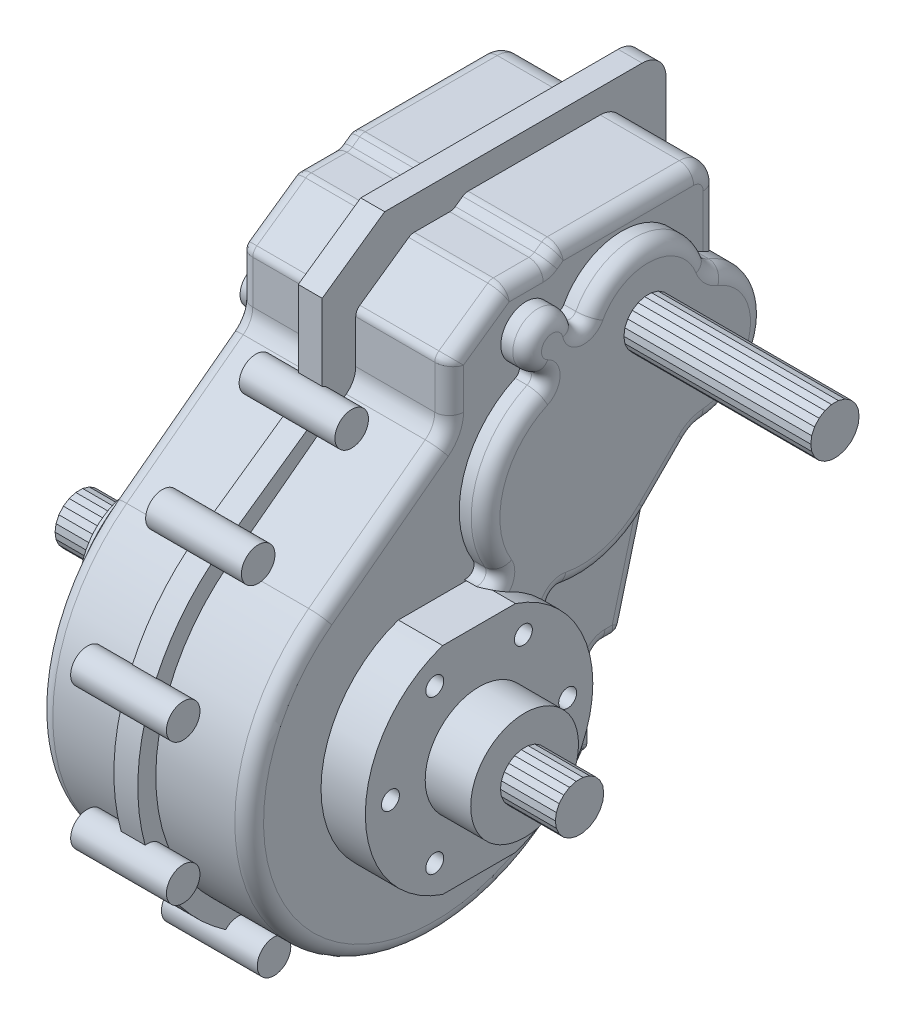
SolidWorks part; units mm, degrees
ref_plane "Front Plane" through (0, 0, 0) normal (0, 0, 1) x (1, 0, 0)
ref_plane "Top Plane" through (0, 0, 0) normal (0, 1, 0) x (1, 0, 0)
ref_plane "Right Plane" through (0, 0, 0) normal (1, 0, 0) x (0, 0, -1)
sketch "Sketch1" plane through (0, 0, 0) normal (1, 0, 0) x (0, 0, -1)
  line L0 (0, 0) -> (99.1616, 141.605) construction
  line L1 (-107.95, 0) -> (107.95, 0) construction
  line L2 (0, 198.755) -> (0, -198.755) construction
  line L3 (3.9933, 137.5321) -> (501.9326, 137.5321) construction
  line L4 (-61.9176, 88.4275) -> (-10.16, 124.6685)
  line L5 (-10.16, 124.6685) -> (-10.16, 175.563)
  line L6 (-10.16, 175.563) -> (22.9616, 198.755)
  line L7 (22.9616, 198.755) -> (159.4866, 198.755)
  line L8 (172.1866, 186.055) -> (172.1866, 149.0291)
  line L9 (169.3968, 142.2939) -> (168.019, 140.9161)
  line L10 (104.3531, -27.6339) -> (129.1752, 66.101)
  circle A0 centre (0, 0) radius 107.95 construction
  circle A1 centre (99.1616, 141.605) radius 33.9725 construction
  circle A2 centre (46.99, 0) radius 4.7625 construction
  circle A3 centre (0, 0) radius 46.99 construction
  circle A4 centre (0, 0) radius 46.99 construction
  circle A5 centre (23.495, -40.6945) radius 4.7625 construction
  circle A6 centre (0, 0) radius 46.99
  circle A7 centre (-23.495, -40.6945) radius 4.7625 construction
  circle A8 centre (0, 0) radius 46.99
  circle A9 centre (-46.99, 0) radius 4.7625 construction
  circle A10 centre (0, 0) radius 46.99
  circle A11 centre (-23.495, 40.6945) radius 4.7625 construction
  circle A12 centre (0, 0) radius 46.99
  circle A13 centre (23.495, 40.6945) radius 4.7625 construction
  circle A14 centre (63.7424, 91.0256) radius 50.8 construction
  circle A15 centre (126.1618, 114.6048) radius 42.8625 construction
  arc A16 (159.4866, 198.755) -> (172.1866, 186.055) centre (159.4866, 186.055) cw
  arc A17 (165.9192, 130.6216) -> (136.1608, 72.9249) centre (126.1618, 114.6048) cw
  arc A18 (-61.9176, 88.4275) -> (104.3531, -27.6339) centre (0, 0) ccw
  arc A19 (172.1866, 149.0291) -> (169.3968, 142.2939) centre (162.6616, 149.0291) cw
  arc A20 (168.019, 140.9161) -> (165.9192, 130.6216) centre (174.7542, 134.1809) ccw
  arc A21 (136.1608, 72.9249) -> (129.1752, 66.101) centre (138.3828, 63.6627) ccw
  point P7 (0, 0)
  point P10 (0, 0)
  point P33 (0, 0)
  point P44 (172.1866, 198.755)
  point P45 (168.7079, 141.605)
  point P54 (163.2294, 136.1265)
  point P57 (130.7338, 71.9868)
  dimension "D3" = 215.9
  dimension "D4" = 67.945
  dimension "D6" = 9.525
  dimension "D9" = 101.6
  dimension "D12" = 85.725
  dimension "D16" = 12.7
  dimension "D21" = 9.525
  dimension "D1" = 141.605
  dimension "D2" = 99.1616
  dimension "D5" = 46.99
  dimension "D8" = 111.125
  dimension "D10" = 27.0002
  dimension "D11" = 27.0002
  dimension "D13" = 57.15
  dimension "D14" = 76.2
  dimension "D15" = 149.225
  dimension "D17" = 135
  dimension "D18" = 10.16
  dimension "D19" = 145
  dimension "D20" = 4.572
  dimension "D7" = 6
extrude "Boss-Extrude1" add sketch "Sketch1" along normal mid plane 12.7 contours A21 A17 A20 L9 A19 L8 A16 L7 L6 L5 L4 A18 L10 A6 | A6
sketch "Sketch3" plane through (0, 0, 0) normal (1, 0, 0) x (0, 0, -1)
  line L0 (-59.2336, 78.6057) -> (2.5631, 125.1728)
  line L1 (7.62, 135.3155) -> (7.62, 158.2365)
  line L2 (9.7862, 162.3978) -> (35.7307, 180.5643)
  line L3 (38.6445, 181.483) -> (57.5024, 181.483)
  line L4 (60.4162, 182.4017) -> (64.3215, 185.1363)
  line L5 (67.2353, 186.055) -> (137.2616, 186.055)
  line L6 (149.9616, 173.355) -> (149.9616, 142.288)
  line L7 (-10.16, 175.563) -> (22.9616, 198.755) construction
  line L8 (-107.95, 0) -> (107.95, 0) construction
  line L9 (0, 198.755) -> (0, -198.755) construction
  line L10 (172.1866, 186.055) -> (172.1866, 149.0291) construction
  line L11 (22.9616, 198.755) -> (159.4866, 198.755) construction
  line L12 (121.223, 70.7996) -> (100.953, -5.7454)
  line L13 (104.3531, -27.6339) -> (129.1752, 66.101) construction
  line L14 (96.0423, -9.525) -> (90.17, -9.525)
  line L15 (85.09, -14.605) -> (85.09, -53.213)
  line L16 (82.55, -55.753) -> (81.1116, -55.753)
  arc A0 (-59.2336, 78.6057) -> (81.1116, -55.753) centre (0, 0) ccw
  arc A1 (151.3743, 138.7726) -> (131.543, 80.0969) centre (126.1618, 114.6048) cw
  arc A2 (64.3215, 185.1363) -> (67.2353, 186.055) centre (67.2353, 180.975) cw
  arc A3 (57.5024, 181.483) -> (60.4162, 182.4017) centre (57.5024, 186.563) ccw
  arc A4 (35.7307, 180.5643) -> (38.6445, 181.483) centre (38.6445, 176.403) cw
  arc A5 (7.62, 158.2365) -> (9.7862, 162.3978) centre (12.7, 158.2365) cw
  arc A6 (149.9616, 142.288) -> (151.3743, 138.7726) centre (155.0416, 142.288) ccw
  arc A7 (90.17, -9.525) -> (85.09, -14.605) centre (90.17, -14.605) ccw
  arc A8 (100.953, -5.7454) -> (96.0423, -9.525) centre (96.0423, -4.445) cw
  arc A9 (85.09, -53.213) -> (82.55, -55.753) centre (82.55, -53.213) cw
  arc A10 (2.5631, 125.1728) -> (7.62, 135.3155) centre (-5.08, 135.3155) ccw
  arc A11 (137.2616, 186.055) -> (149.9616, 173.355) centre (137.2616, 173.355) cw
  arc A12 (131.543, 80.0969) -> (121.223, 70.7996) centre (133.4998, 67.5485) ccw
  point P32 (65.6336, 186.055)
  dimension "D1" = 98.425
  dimension "D9" = 34.925
  dimension "D14" = 5.08
  dimension "D15" = 2.54
  dimension "D16" = 12.7
  dimension "D2" = 37
  dimension "D3" = 7.62
  dimension "D4" = 22.225
  dimension "D5" = 22.225
  dimension "D6" = 12.7
  dimension "D7" = 4.572
  dimension "D8" = 33.528
  dimension "D10" = 8.89
  dimension "D11" = 85.09
  dimension "D12" = 9.525
  dimension "D13" = 46.228
extrude "Boss-Extrude2" add sketch "Sketch3" along normal mid plane 111.76
sketch "Sketch4" plane through (0, 0, 0) normal (1, 0, 0) x (0, 0, -1)
  circle A0 centre (0, 0) radius 28.575
  dimension "D1" = 57.15
extrude "Boss-Extrude3" add sketch "Sketch4" along normal mid plane 207.0608
sketch "Sketch5" plane through (0, 0, 0) normal (1, 0, 0) x (0, 0, -1)
  line L0 (-1.826, 12.7) -> (-5.33, 11.6711)
  line L1 (12.8306, 0) -> (12.3109, 3.6148)
  line L2 (12.3109, 3.6148) -> (10.7938, 6.9367)
  line L3 (10.7938, 6.9367) -> (8.4023, 9.6967)
  line L4 (8.4023, 9.6967) -> (5.33, 11.6711)
  line L5 (5.33, 11.6711) -> (1.826, 12.7)
  line L6 (1.826, 12.7) -> (-1.826, 12.7)
  line L7 (-5.33, 11.6711) -> (-8.4023, 9.6967)
  line L8 (-8.4023, 9.6967) -> (-10.7938, 6.9367)
  line L9 (-10.7938, 6.9367) -> (-12.3109, 3.6148)
  line L10 (-12.3109, 3.6148) -> (-12.8306, 0)
  line L11 (-12.8306, 0) -> (-12.3109, -3.6148)
  line L12 (-12.3109, -3.6148) -> (-10.7938, -6.9367)
  line L13 (-10.7938, -6.9367) -> (-8.4023, -9.6967)
  line L14 (-8.4023, -9.6967) -> (-5.33, -11.6711)
  line L15 (-5.33, -11.6711) -> (-1.826, -12.7)
  line L16 (-1.826, -12.7) -> (1.826, -12.7)
  line L17 (1.826, -12.7) -> (5.33, -11.6711)
  line L18 (5.33, -11.6711) -> (8.4023, -9.6967)
  line L19 (8.4023, -9.6967) -> (10.7938, -6.9367)
  line L20 (10.7938, -6.9367) -> (12.3109, -3.6148)
  line L21 (12.3109, -3.6148) -> (12.8306, 0)
  line L22 (-107.95, 0) -> (107.95, 0) construction
  circle A0 centre (0, 0) radius 12.7 construction
  dimension "D1" = 25.4
extrude "Boss-Extrude4" add sketch "Sketch5" along normal mid plane 265.3284
sketch "Sketch6" plane through (0, 0, 0) normal (1, 0, 0) x (0, 0, -1)
  line L0 (19.3128, 57.15) -> (-19.3128, 57.15)
  line L1 (-19.3128, -57.15) -> (19.3128, -57.15)
  arc A0 (19.3128, 57.15) -> (19.3128, -57.15) centre (0, 0) cw
  arc A1 (-19.3128, 57.15) -> (-19.3128, -57.15) centre (0, 0) ccw
  circle A2 centre (46.99, 0) radius 4.7625
  circle A3 centre (23.495, 40.6945) radius 4.7625
  circle A4 centre (-23.495, 40.6945) radius 4.7625
  circle A5 centre (-46.99, 0) radius 4.7625
  circle A6 centre (-23.495, -40.6945) radius 4.7625
  circle A7 centre (23.495, -40.6945) radius 4.7625
  dimension "D1" = 60.325
  dimension "D3" = 9.525
  dimension "D2" = 114.3
extrude "Boss-Extrude5" add sketch "Sketch6" along normal mid plane 158.75
sketch "Sketch7" plane through (0, 0, 0) normal (1, 0, 0) x (0, 0, -1)
  line L0 (20.2141, 64.8355) -> (15.6157, 58.2688) construction
  line L1 (54.0152, 41.1656) -> (49.4168, 34.599) construction
  line L2 (15.6157, 58.2688) -> (49.4168, 34.599) construction
  line L3 (0, 0) -> (15.6157, 58.2688) construction
  line L4 (0, 0) -> (49.4168, 34.599) construction
  line L5 (0, 0) -> (99.1616, 141.605) construction
  line L6 (99.662, 55.1031) -> (120.6472, 76.0867)
  arc A0 (42.6378, 137.2342) -> (20.2141, 64.8355) centre (63.7424, 91.0256) ccw
  circle A1 centre (63.7424, 91.0256) radius 50.8 construction
  arc A2 (54.0152, 41.1656) -> (99.662, 55.1031) centre (63.7424, 91.0256) ccw
  arc A3 (15.6157, 58.2688) -> (49.4168, 34.599) centre (0, 0) cw
  arc A4 (19.3128, -57.15) -> (19.3128, 57.15) centre (0, 0) ccw construction
  arc A5 (20.2141, 64.8355) -> (15.6157, 58.2688) centre (16.4556, 62.5741) cw
  arc A6 (54.0152, 41.1656) -> (49.4168, 34.599) centre (53.1753, 36.8604) ccw
  arc A7 (128.703, 79.7724) -> (138.8862, 147.1293) centre (126.1618, 114.6048) ccw
  arc A8 (131.543, 80.0969) -> (151.3743, 138.7726) centre (126.1618, 114.6048) ccw construction
  arc A9 (131.6861, 154.3294) -> (68.432, 158.2016) centre (99.1616, 141.605) ccw
  arc A10 (42.6786, 144.1466) -> (61.3646, 159.1672) centre (48.3616, 156.21) cw
  arc A11 (42.6378, 137.2342) -> (42.6786, 144.1466) centre (41.0549, 140.6999) ccw
  arc A12 (61.3646, 159.1672) -> (68.432, 158.2016) centre (65.0797, 160.0122) ccw
  arc A13 (138.8862, 147.1293) -> (131.6861, 154.3294) centre (143.5132, 158.9564) cw
  arc A14 (128.703, 79.7724) -> (120.6472, 76.0867) centre (129.6271, 67.106) ccw
  point P10 (32.5162, 46.4339)
  dimension "D2" = 34.925
  dimension "D5" = 13.335
  dimension "D6" = 3.81
  dimension "D8" = 12.7
  dimension "D1" = 40
  dimension "D3" = 50.8
  dimension "D4" = 14.605
  dimension "D7" = 10
extrude "Boss-Extrude6" add sketch "Sketch7" along normal blind 69.85
sketch "Sketch8" plane through (0, 0, 0) normal (1, 0, 0) x (0, 0, -1)
  line L1 (111.9922, 141.605) -> (111.4725, 145.2198)
  line L2 (111.4725, 145.2198) -> (109.9554, 148.5417)
  line L3 (109.9554, 148.5417) -> (107.5639, 151.3017)
  line L4 (107.5639, 151.3017) -> (104.4916, 153.2761)
  line L5 (104.4916, 153.2761) -> (100.9876, 154.305)
  line L6 (100.9876, 154.305) -> (97.3356, 154.305)
  line L7 (97.3356, 154.305) -> (93.8316, 153.2761)
  line L8 (93.8316, 153.2761) -> (90.7593, 151.3017)
  line L9 (90.7593, 151.3017) -> (88.3678, 148.5417)
  line L10 (88.3678, 148.5417) -> (86.8507, 145.2198)
  line L11 (86.8507, 145.2198) -> (86.331, 141.605)
  line L12 (86.331, 141.605) -> (86.8507, 137.9902)
  line L13 (86.8507, 137.9902) -> (88.3678, 134.6683)
  line L14 (88.3678, 134.6683) -> (90.7593, 131.9083)
  line L15 (90.7593, 131.9083) -> (93.8316, 129.9339)
  line L16 (93.8316, 129.9339) -> (97.3356, 128.905)
  line L17 (97.3356, 128.905) -> (100.9876, 128.905)
  line L18 (100.9876, 128.905) -> (104.4916, 129.9339)
  line L19 (104.4916, 129.9339) -> (107.5639, 131.9083)
  line L20 (107.5639, 131.9083) -> (109.9554, 134.6683)
  line L21 (109.9554, 134.6683) -> (111.4725, 137.9902)
  line L22 (111.4725, 137.9902) -> (111.9922, 141.605)
  circle A0 centre (99.1616, 141.605) radius 12.7 construction
  dimension "D1" = 25.4
extrude "Boss-Extrude7" add sketch "Sketch8" along normal blind 168.9354
sketch "Sketch9" plane through (0, 0, 0) normal (1, 0, 0) x (0, 0, -1)
  circle A0 centre (63.7424, 91.0256) radius 9.525
  dimension "D1" = 19.05
extrude "Boss-Extrude8" add sketch "Sketch9" against normal blind 101.6
sketch "Sketch10" plane through (0, 0, 0) normal (1, 0, 0) x (0, 0, -1)
  line L3 (0, 0) -> (-23.495, -40.6945) construction
  line L4 (2.5631, 125.1728) -> (-59.2336, 78.6057) construction
  circle A0 centre (0, 0) radius 109.5375 construction
  circle A1 centre (-54.7688, -94.8623) radius 8.89
  circle A2 centre (-102.9316, -37.464) radius 8.89
  circle A3 centre (-102.9316, 37.464) radius 8.89
  circle A4 centre (-63.1693, 89.488) radius 8.89
  circle A5 centre (-13.5702, 126.8801) radius 8.89
  arc A6 (-5.3026, 130.148) -> (6.2857, 129.6488) centre (0.6028, 132.4822) ccw
  arc A7 (2.5631, 125.1728) -> (7.62, 135.3155) centre (-5.08, 135.3155) ccw construction
  circle A8 centre (83.9106, -70.4093) radius 8.89
  circle A9 centre (19.021, -107.8734) radius 8.89
  circle A10 centre (-54.7687, 94.8623) radius 8.89
  circle A11 centre (19.021, 107.8734) radius 8.89
  circle A12 centre (83.9106, 70.4093) radius 8.89
  circle A13 centre (109.5375, 0) radius 8.89
  arc A14 (-18.6626, 119.5932) -> (-18.4785, 109.3169) centre (-22.3001, 114.3882) cw
  arc A15 (-54.7636, 92.3823) -> (-44.938, 89.3782) centre (-48.7595, 94.4496) ccw
  arc A16 (-67.9773, 82.0104) -> (-67.0837, 72.0226) centre (-71.4117, 76.6693) cw
  arc A17 (-59.2336, 78.6057) -> (81.1116, -55.753) centre (0, 0) ccw construction
  arc A18 (-96.9783, 44.0663) -> (-87.1062, 45.8257) centre (-92.7259, 48.7822) ccw
  arc A20 (-59.2336, 78.6057) -> (81.1116, -55.753) centre (0, 0) ccw construction
  arc A21 (-102.6149, 28.5797) -> (-96.1834, 20.8862) centre (-102.3888, 22.2337) cw
  arc A22 (-102.6149, -28.5797) -> (-96.1834, -20.8862) centre (-102.3888, -22.2337) ccw
  arc A23 (-96.9783, -44.0663) -> (-87.1062, -45.8257) centre (-92.7259, -48.7822) cw
  arc A24 (-60.237, -87.8529) -> (-60.2554, -77.8253) centre (-64.1428, -82.8462) ccw
  arc A25 (-45.9644, -96.0932) -> (-37.271, -91.0953) centre (-39.6755, -96.9724) cw
  arc A26 (10.3266, -106.0188) -> (3.8668, -98.349) centre (4.1163, -104.6941) ccw
  arc A27 (26.5568, -103.157) -> (30.0037, -93.7404) centre (31.9394, -99.7881) cw
  arc A28 (66.1797, -72.8542) -> (76.0582, -74.5773) centre (70.4493, -77.5544) cw
  arc A29 (87.7418, -62.3873) -> (84.3461, -55.0091) centre (90.4784, -56.6572) cw
  arc A30 (82.55, -55.753) -> (85.09, -53.213) centre (82.55, -53.213) ccw construction
  point P25 (0, 0)
  dimension "D1" = 219.075
  dimension "D2" = 17.78
  dimension "D3" = 9
  dimension "D4" = 6.35
extrude "Boss-Extrude9" add sketch "Sketch10" along normal mid plane 50.8 contours A4 | A5 | A3 | A8 | A2 | A1 | A9
fillet "Fillet2" radius 7.62 59 edges at (-55.88, -55.753, -81.8308) (-55.88, -55.0091, -84.3461) (-55.88, -33.909, -85.09) (-55.88, -11.0129, -86.5779) (-55.88, -9.525, -93.1061) (-55.88, -8.4707, -99.1407) (-55.88, 32.5271, -111.088) (-55.88, 76.9841, -124.9993) (-55.88, 103.4222, -159.2481) (-55.88, 140.3937, -150.328) (-55.88, 157.8215, -149.9616) (-55.88, 182.3353, -146.2419) (-55.88, 186.055, -102.2485) (-55.88, 185.8199, -65.7077) (-55.88, 183.769, -62.3689) (-55.88, 181.7181, -59.03) (-55.88, 181.483, -48.0734) (-55.88, 181.2479, -37.1169) (-55.88, 171.481, -22.7585) (-55.88, 160.5822, -8.194) (-55.88, 146.776, -7.62) (-55.88, 129.6488, -6.2857) (-55.88, 101.8893, 28.3353) (55.88, 140.3937, -150.328) (55.88, 157.8215, -149.9616) (55.88, 182.3353, -146.2419) (55.88, 186.055, -102.2485) (55.88, 185.8199, -65.7077) (55.88, 183.769, -62.3689) (55.88, 181.7181, -59.03) (55.88, 181.483, -48.0734) (55.88, 181.2479, -37.1169) (55.88, 171.481, -22.7585) (55.88, 160.5822, -8.194) (55.88, 146.776, -7.62) (55.88, 129.6488, -6.2857) (55.88, 101.8893, 28.3353) (-55.88, -71.0968, 68.0641) (55.88, -71.0968, 68.0641) (55.88, -55.753, -81.8308) (55.88, -55.0091, -84.3461) (55.88, 76.9841, -124.9993) (55.88, 32.5271, -111.088) (55.88, -8.4707, -99.1407) (55.88, -9.525, -93.1061) (55.88, -11.0129, -86.5779) (55.88, -33.909, -85.09) (69.85, 39.3765, -49.5823) (69.85, 42.44, -78.5773) (69.85, 65.5949, -110.1546) (69.85, 78.6547, -124.3434) (69.85, 109.3841, -160.6944) (69.85, 149.9762, -134.533) (69.85, 176.4647, -101.2956) (69.85, 156.2372, -64.5639) (69.85, 166.6033, -40.0069) (69.85, 140.6774, -44.8649) (69.85, 60.058, -20.0486) (69.85, 106.0553, -15.2167)
